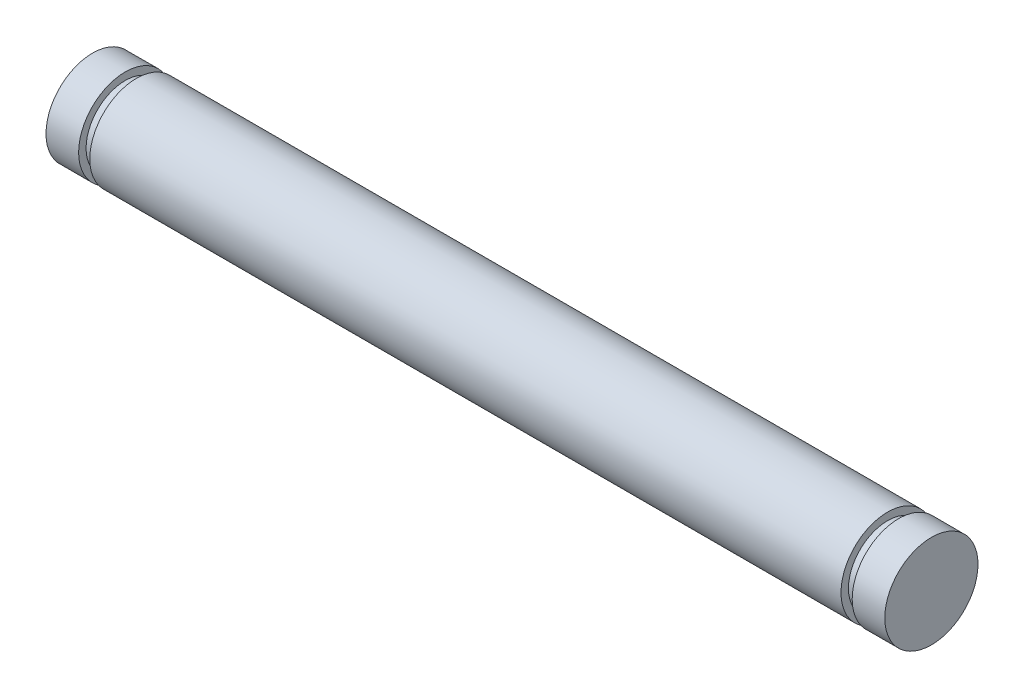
SolidWorks part; units mm, degrees
ref_plane "Front Plane" through (0, 0, 0) normal (0, 0, 1) x (1, 0, 0)
ref_plane "Top Plane" through (0, 0, 0) normal (0, 1, 0) x (1, 0, 0)
ref_plane "Right Plane" through (0, 0, 0) normal (1, 0, 0) x (0, 0, -1)
sketch "Sketch1" plane through (0, 0, 0) normal (1, 0, 0) x (0, 0, -1)
  circle A0 centre (0, 0) radius 3.175
  dimension "D1" = 6.35
extrude "Boss-Extrude1" add sketch "Sketch1" along normal blind 57.15
sketch "Sketch2" plane through (0, 0, 0) normal (0, 1, 0) x (1, 0, 0)
  line L0 (57.15, 3.175) -> (0, 3.175) construction
  line L1 (2.2225, 3.175) -> (2.9845, 3.175)
  line L2 (2.2225, 3.175) -> (2.2225, 2.667)
  line L3 (2.2225, 2.667) -> (2.9845, 2.667)
  line L4 (2.9845, 3.175) -> (2.9845, 2.667)
  line L5 (28.575, 3.175) -> (28.575, -3.175) construction
  line L6 (0, -3.175) -> (57.15, -3.175) construction
  line L7 (54.1655, 3.175) -> (54.1655, 2.667)
  line L8 (54.9275, 2.667) -> (54.1655, 2.667)
  line L9 (54.9275, 3.175) -> (54.9275, 2.667)
  line L10 (54.9275, 3.175) -> (54.1655, 3.175)
  line L11 (0, 0) -> (57.15, 0) construction
  line L12 (57.15, -3.175) -> (57.15, 3.175) construction
  line L13 (0, 3.175) -> (0, -3.175) construction
  point P14 (28.575, 0)
  dimension "D1" = 0.762
  dimension "D2" = 51.181
  dimension "D3" = 2.667
  dimension "D4" = 2.2225
  dimension "D5" = 2.9845
revolve "Cut-Revolve1" cut sketch "Sketch2" angle 360 about L11
